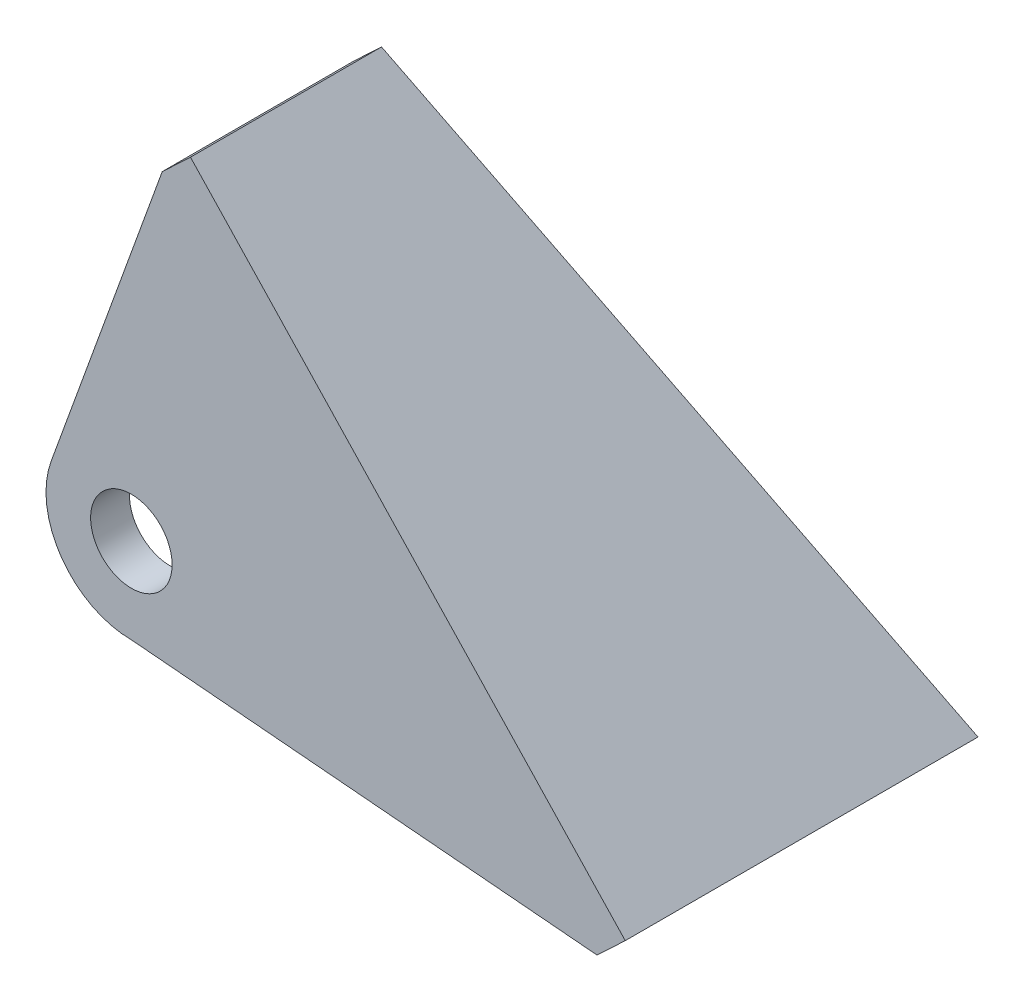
SolidWorks part; units mm, degrees
ref_plane "Plan de face" through (0, 0, 0) normal (0, 0, 1) x (1, 0, 0)
ref_plane "Plan de dessus" through (0, 0, 0) normal (0, 1, 0) x (1, 0, 0)
ref_plane "Plan de droite" through (0, 0, 0) normal (1, 0, 0) x (0, 0, -1)
sketch "Esquisse1" plane through (0, 0, -20) normal (0, 0, 1) x (1, 0, 0)
  line L0 (-25.3409, -6.2497) -> (-11.0215, 33.2339)
  line L1 (-15, -21) -> (45, -26.1797)
  line L2 (-65.6292, 88.4666) -> (99.9187, -83.0927) construction
  line L3 (-11.0215, 33.2339) -> (45, -26.1797)
  line L4 (115, 141.2414) -> (115, -487.7469) construction
  circle A0 centre (-15, -10) radius 5.25
  arc A1 (-25.3409, -6.2497) -> (-15, -21) centre (-15, -10) ccw
  dimension "D1" = 10.5
  dimension "D2" = 22
  dimension "D3" = 70
  dimension "D4" = 42
  dimension "D5" = 75
extrude "Extrusion1" add sketch "Esquisse1" along normal blind 5
sketch "Esquisse2" plane through (10.7539, 10.1399, 0) normal (0.7276, 0.686, 0) x (0, 0, -1)
  line L0 (15, 31.7412) -> (39.6117, 31.7412)
  line L1 (15, 31.7412) -> (15, -49.9191)
  line L2 (15, -49.9191) -> (60.448, -49.9191)
  line L3 (60.448, -49.9191) -> (39.6117, 31.7412)
extrude "Boss.-Extru.1" add sketch "Esquisse2" along normal blind 5
